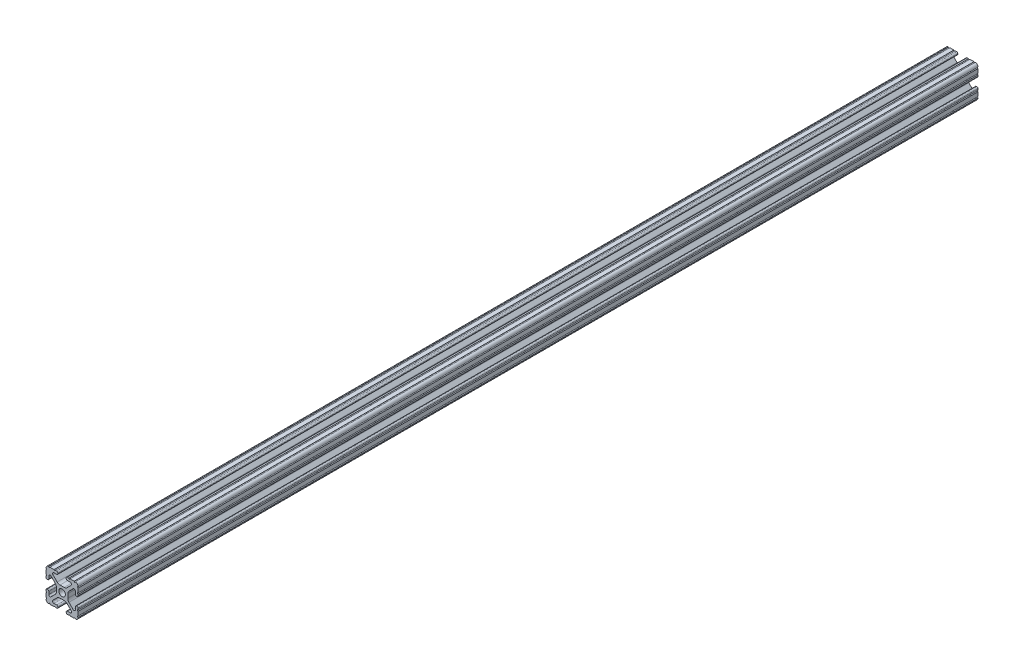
SolidWorks part; units mm, degrees
ref_plane "Front Plane" through (0, 0, 0) normal (0, 0, 1) x (1, 0, 0)
ref_plane "Top Plane" through (0, 0, 0) normal (0, 1, 0) x (1, 0, 0)
ref_plane "Right Plane" through (0, 0, 0) normal (1, 0, 0) x (0, 0, -1)
sketch "Sketch1" plane through (0, 0, 0) normal (0, 0, 1) x (1, 0, 0)
  line L0 (-7.207, 8.7244) -> (-3.8983, 5.4232)
  line L1 (-4.2875, 10.4902) -> (-6.4768, 10.4902)
  line L2 (-3.2385, 11.651) -> (-3.2385, 11.5392)
  line L3 (-5.3171, 12.7) -> (-4.2875, 12.7)
  line L4 (0, 13.4005) -> (0, -14.8534) construction
  line L5 (12.7, 0) -> (-13.9989, 0) construction
  line L6 (-9.5504, 12.7) -> (-6.3331, 12.7)
  line L7 (-12.7, 6.3331) -> (-12.7, 9.5504)
  line L8 (-12.7, 4.2875) -> (-12.7, 5.3171)
  line L9 (-11.5392, 3.2385) -> (-11.651, 3.2385)
  line L10 (-10.4902, 6.4021) -> (-10.4902, 4.2875)
  line L11 (-5.441, 3.8408) -> (-8.7371, 7.1294)
  line L12 (-4.5085, -1.5932) -> (-4.5085, 1.5932)
  line L13 (-1.7093, -4.4958) -> (1.7093, -4.4958)
  line L14 (3.9523, -5.4237) -> (7.1797, -8.6452)
  line L15 (6.4164, -10.4902) -> (4.2875, -10.4902)
  line L16 (3.2385, -11.5392) -> (3.2385, -11.651)
  line L17 (4.2875, -12.7) -> (5.3171, -12.7)
  line L18 (6.3331, -12.7) -> (9.5504, -12.7)
  line L19 (12.7, -9.5504) -> (12.7, -6.3331)
  line L20 (12.7, -5.3171) -> (12.7, -4.2875)
  line L21 (11.651, -3.2385) -> (11.5392, -3.2385)
  line L22 (10.4902, -4.2875) -> (10.4902, -6.4021)
  line L23 (8.7371, -7.1294) -> (5.441, -3.8408)
  line L24 (4.5085, -1.5932) -> (4.5085, 1.5932)
  line L25 (5.441, 3.8408) -> (8.7371, 7.1294)
  line L26 (10.4902, 6.4021) -> (10.4902, 4.2875)
  line L27 (11.5392, 3.2385) -> (11.651, 3.2385)
  line L28 (12.7, 4.2875) -> (12.7, 5.3171)
  line L29 (12.7, 6.3331) -> (12.7, 9.5504)
  line L30 (9.5504, 12.7) -> (6.3331, 12.7)
  line L31 (5.3171, 12.7) -> (4.2875, 12.7)
  line L32 (3.2385, 11.651) -> (3.2385, 11.5392)
  line L33 (4.2875, 10.4902) -> (6.4768, 10.4902)
  line L34 (7.207, 8.7244) -> (3.8983, 5.4232)
  line L35 (1.6558, 4.4958) -> (-1.6558, 4.4958)
  line L36 (-8.7371, -7.1294) -> (-5.441, -3.8408)
  line L37 (-10.4902, -4.2875) -> (-10.4902, -6.4021)
  line L38 (-11.651, -3.2385) -> (-11.5392, -3.2385)
  line L39 (-12.7, -5.3171) -> (-12.7, -4.2875)
  line L40 (-12.7, -9.5504) -> (-12.7, -6.3331)
  line L41 (-6.3331, -12.7) -> (-9.5504, -12.7)
  line L42 (-4.2875, -12.7) -> (-5.3171, -12.7)
  line L43 (-3.2385, -11.5392) -> (-3.2385, -11.651)
  line L44 (-6.4164, -10.4902) -> (-4.2875, -10.4902)
  line L45 (-3.9523, -5.4237) -> (-7.1797, -8.6452)
  arc A0 (-7.207, 8.7244) -> (-6.4768, 10.4902) centre (-6.4768, 9.4563) cw
  arc A1 (-3.2385, 11.5392) -> (-4.2875, 10.4902) centre (-4.2875, 11.5392) cw
  arc A2 (-4.2875, 12.7) -> (-3.2385, 11.651) centre (-4.2875, 11.651) cw
  arc A3 (-5.3171, 12.7) -> (-6.3331, 12.7) centre (-5.8251, 12.7) cw
  arc A4 (-9.5504, 12.7) -> (-10.5664, 12.6998) centre (-10.0584, 12.7) cw
  arc A5 (-12.6998, 10.5664) -> (-10.5664, 12.6998) centre (-10.5918, 10.5918) cw
  arc A6 (-12.6998, 10.5664) -> (-12.7, 9.5504) centre (-12.7, 10.0584) cw
  arc A7 (-12.7, 6.3331) -> (-12.7, 5.3171) centre (-12.7, 5.8251) cw
  arc A8 (-11.651, 3.2385) -> (-12.7, 4.2875) centre (-11.651, 4.2875) cw
  arc A9 (-10.4902, 4.2875) -> (-11.5392, 3.2385) centre (-11.5392, 4.2875) cw
  circle A10 centre (0, 0) radius 2.6035
  arc A11 (-10.4902, 6.4021) -> (-8.7371, 7.1294) centre (-9.4628, 6.4021) cw
  arc A12 (-5.441, 3.8408) -> (-4.5085, 1.5932) centre (-7.6835, 1.5932) cw
  arc A13 (-4.5085, -1.5932) -> (-5.441, -3.8408) centre (-7.6835, -1.5932) cw
  arc A14 (-8.7371, -7.1294) -> (-10.4902, -6.4021) centre (-9.4628, -6.4021) cw
  arc A15 (-1.7093, -4.4958) -> (-3.9523, -5.4237) centre (-1.7093, -7.6708) ccw
  arc A16 (3.9523, -5.4237) -> (1.7093, -4.4958) centre (1.7093, -7.6708) ccw
  arc A17 (6.4164, -10.4902) -> (7.1797, -8.6452) centre (6.4164, -9.4098) ccw
  arc A18 (4.2875, -10.4902) -> (3.2385, -11.5392) centre (4.2875, -11.5392) ccw
  arc A19 (3.2385, -11.651) -> (4.2875, -12.7) centre (4.2875, -11.651) ccw
  arc A20 (6.3331, -12.7) -> (5.3171, -12.7) centre (5.8251, -12.7) ccw
  arc A21 (10.5664, -12.6998) -> (9.5504, -12.7) centre (10.0584, -12.7) ccw
  arc A22 (10.5664, -12.6998) -> (12.6998, -10.5664) centre (10.5918, -10.5918) ccw
  arc A23 (12.7, -9.5504) -> (12.6998, -10.5664) centre (12.7, -10.0584) ccw
  arc A24 (12.7, -5.3171) -> (12.7, -6.3331) centre (12.7, -5.8251) ccw
  arc A25 (12.7, -4.2875) -> (11.651, -3.2385) centre (11.651, -4.2875) ccw
  arc A26 (11.5392, -3.2385) -> (10.4902, -4.2875) centre (11.5392, -4.2875) ccw
  arc A27 (8.7371, -7.1294) -> (10.4902, -6.4021) centre (9.4628, -6.4021) ccw
  arc A28 (4.5085, -1.5932) -> (5.441, -3.8408) centre (7.6835, -1.5932) ccw
  arc A29 (5.441, 3.8408) -> (4.5085, 1.5932) centre (7.6835, 1.5932) ccw
  arc A30 (10.4902, 6.4021) -> (8.7371, 7.1294) centre (9.4628, 6.4021) ccw
  arc A31 (10.4902, 4.2875) -> (11.5392, 3.2385) centre (11.5392, 4.2875) ccw
  arc A32 (11.651, 3.2385) -> (12.7, 4.2875) centre (11.651, 4.2875) ccw
  arc A33 (12.7, 6.3331) -> (12.7, 5.3171) centre (12.7, 5.8251) ccw
  arc A34 (12.6998, 10.5664) -> (12.7, 9.5504) centre (12.7, 10.0584) ccw
  arc A35 (12.6998, 10.5664) -> (10.5664, 12.6998) centre (10.5918, 10.5918) ccw
  arc A36 (9.5504, 12.7) -> (10.5664, 12.6998) centre (10.0584, 12.7) ccw
  arc A37 (5.3171, 12.7) -> (6.3331, 12.7) centre (5.8251, 12.7) ccw
  arc A38 (4.2875, 12.7) -> (3.2385, 11.651) centre (4.2875, 11.651) ccw
  arc A39 (3.2385, 11.5392) -> (4.2875, 10.4902) centre (4.2875, 11.5392) ccw
  arc A40 (7.207, 8.7244) -> (6.4768, 10.4902) centre (6.4768, 9.4563) ccw
  arc A41 (1.6558, 4.4958) -> (3.8983, 5.4232) centre (1.6558, 7.6708) ccw
  arc A42 (-1.6558, 4.4958) -> (-3.8983, 5.4232) centre (-1.6558, 7.6708) cw
  arc A43 (-11.5392, -3.2385) -> (-10.4902, -4.2875) centre (-11.5392, -4.2875) cw
  arc A44 (-12.7, -4.2875) -> (-11.651, -3.2385) centre (-11.651, -4.2875) cw
  arc A45 (-12.7, -5.3171) -> (-12.7, -6.3331) centre (-12.7, -5.8251) cw
  arc A46 (-12.7, -9.5504) -> (-12.6998, -10.5664) centre (-12.7, -10.0584) cw
  arc A47 (-10.5664, -12.6998) -> (-12.6998, -10.5664) centre (-10.5918, -10.5918) cw
  arc A48 (-10.5664, -12.6998) -> (-9.5504, -12.7) centre (-10.0584, -12.7) cw
  arc A49 (-6.3331, -12.7) -> (-5.3171, -12.7) centre (-5.8251, -12.7) cw
  arc A50 (-3.2385, -11.651) -> (-4.2875, -12.7) centre (-4.2875, -11.651) cw
  arc A51 (-4.2875, -10.4902) -> (-3.2385, -11.5392) centre (-4.2875, -11.5392) cw
  arc A52 (-6.4164, -10.4902) -> (-7.1797, -8.6452) centre (-6.4164, -9.4098) cw
  dimension "D1" = 5.207
  dimension "D9" = 14.859
  dimension "D2" = 25.4
  dimension "D3" = 12.7
  dimension "D4" = 6.477
  dimension "D5" = 8.2042
  dimension "D6" = 9.017
  dimension "D8" = 2.2098
  dimension "D10" = 2.2098
extrude "Extrude1" add sketch "Sketch1" against normal blind 711.2
